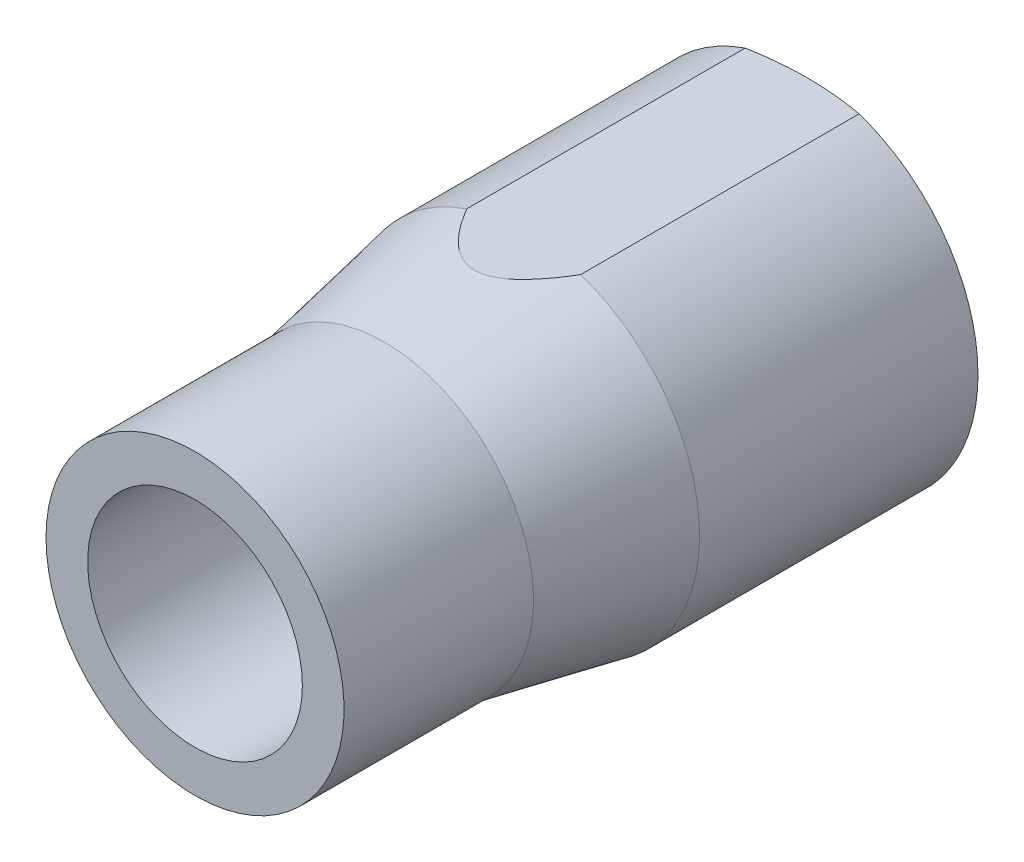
SolidWorks part; units mm, degrees
ref_plane "Front Plane" through (0, 0, 0) normal (0, 0, 1) x (1, 0, 0)
ref_plane "Top Plane" through (0, 0, 0) normal (0, 1, 0) x (1, 0, 0)
ref_plane "Right Plane" through (0, 0, 0) normal (1, 0, 0) x (0, 0, -1)
sketch "Sketch1" plane through (0, 0, 0) normal (0, 0, 1) x (1, 0, 0)
  circle A0 centre (0, 0) radius 5.2451
  dimension "D1" = 10.4902
extrude "Boss-Extrude1" add sketch "Sketch1" along normal blind 9.7155
chamfer "Chamfer1" distance 2.54 angle 29 1 edges at (5.2451, 0, 0)
ref_plane "Plane1" through (0, 0, 13.8684) normal (0, 0, 1) x (1, 0, 0)
sketch "Sketch2" plane through (0, 0, 13.8684) normal (0, 0, 1) x (1, 0, 0)
  circle A0 centre (0, 0) radius 4.445
  dimension "D1" = 8.89
loft "Loft1" add profiles "Sketch2"
sketch "Sketch3" plane through (0, 0, 13.8684) normal (0, 0, 1) x (1, 0, 0)
  circle A1 centre (0, 0) radius 4.445
extrude "Boss-Extrude2" add sketch "Sketch3" along normal blind 5.6515
sketch "Sketch4" plane through (0, 0, 0) normal (0, 0, -1) x (-1, 0, 0)
  circle A0 centre (0, 0) radius 2.0699
extrude "Cut-Extrude1" cut sketch "Sketch4" against normal blind 13.7795
sketch "Sketch5" plane through (0, 0, 0) normal (0, 0, -1) x (-1, 0, 0)
  line L0 (0, 0) -> (-6.219, 0) construction
  line L1 (-7.7883, 4.9621) -> (7.3814, 4.9621)
  line L2 (-7.7883, 4.9621) -> (-7.7883, -4.9621)
  line L3 (-7.7883, -4.9621) -> (7.3814, -4.9621)
  line L4 (7.3814, 4.9621) -> (7.3814, -4.9621)
extrude "Cut-Extrude2" cut sketch "Sketch5" against normal blind 11.7475 flip side to cut
sketch "Sketch6" plane through (0, 0, 19.5199) normal (0, 0, 1) x (1, 0, 0)
  circle A0 centre (0, 0) radius 3.2024
extrude "Cut-Extrude3" cut sketch "Sketch6" against normal blind 8.1915
